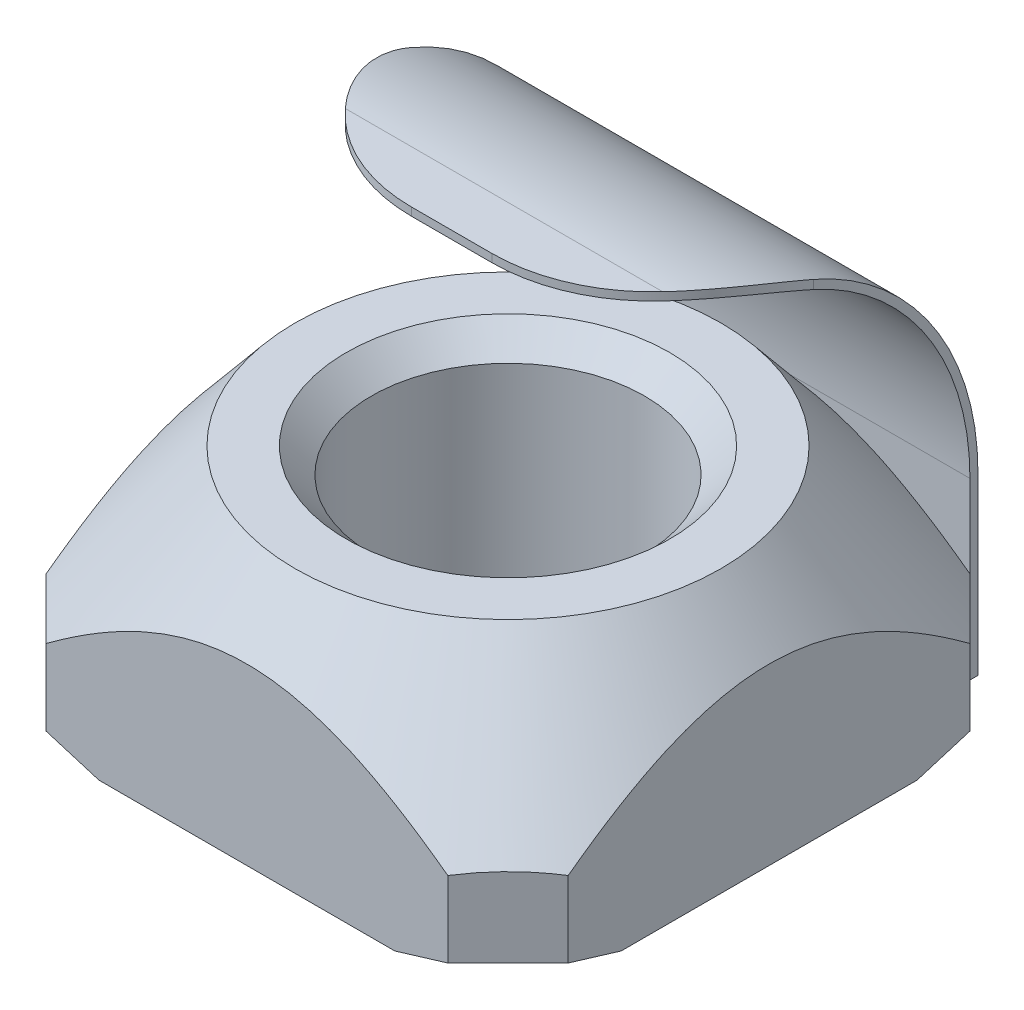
SolidWorks part; units mm, degrees
ref_plane "Front Plane" through (0, 0, 0) normal (0, 0, 1) x (1, 0, 0)
ref_plane "Top Plane" through (0, 0, 0) normal (0, 1, 0) x (1, 0, 0)
ref_plane "Right Plane" through (0, 0, 0) normal (1, 0, 0) x (0, 0, -1)
imported_body "Imported3"
sketch "Sketch1" plane through (0, 0, -6.5) normal (0, 0, -1) x (-1, 0, 0)
  line L0 (5, 11.1468) -> (5, 0)
  line L1 (5, 0) -> (-5, 0)
  line L2 (-5, 0) -> (-5, 11.1468)
  line L3 (-5, 11.1468) -> (5, 11.1468)
  line L4 (5.0002, 2.2872) -> (5.0002, 0.4294) construction
  dimension "D1" = 0.0002
  dimension "D2" = 10.0002
  dimension "D3" = 10.7175
  dimension "D4" = 0.4294
extrude "Boss-Extrude1" add sketch "Sketch1" along normal blind 0.2
sketch "Sketch2" plane through (0, 0, -6.5) normal (0, 0, 1) x (1, 0, 0)
  line L0 (-5, 11.1468) -> (5, 11.1468)
  line L1 (5, 11.1468) -> (5, 10.9468)
  line L2 (5, 10.9468) -> (-5, 10.9468)
  line L3 (-5, 10.9468) -> (-5, 11.1468)
  line L4 (-5.0001, 2.2872) -> (-5, 11.1468) construction
  dimension "D1" = 10
  dimension "D2" = 0.2
extrude "Boss-Extrude2" add sketch "Sketch2" along normal blind 7.9
hole_wizard "Ø6.8 (6.8) Diameter Hole1" positions "Sketch4" profile "Sketch3" hole size "Ø6.8" standard "ANSI Metric"
sketch "Sketch4" plane through (0, 5.8, 0) normal (0, 1, 0) x (1, 0, 0)
  point P0 (0, 0)
sketch "Sketch3" plane through (0, 5.8, 0) normal (1, 0, 0) x (0, 0, 1)
  line L0 (0, 0) -> (0, 5.8071)
  line L1 (0, 5.8071) -> (3.4, 5.8071)
  line L2 (3.4, 5.8071) -> (3.4, 0)
  line L5 (3.4, 0) -> (0, 0)
  line L11 (0, -6.35) -> (0, 107.95) construction
  dimension "Thru Hole Dia." = 6.8
  dimension "Thru Hole Depth" = 5.8071
fillet "Fillet1" radius 6.6 1 edges at (0, 10.9468, -6.5)
chamfer "Chamfer1" distance 1.4991 angle 45 2 edges at (-6.5, 0.5432, 6.5) (6.5, 0.5432, 6.5)
chamfer "Chamfer2" distance 0.4 angle 66.78 2 edges at (5.7505, 0, 5.7505)
chamfer "Chamfer3" distance 0.625 angle 45 1 edges at (0, 5.8, 3.4)
chamfer "Chamfer4" distance 0.9324 angle 23.22 1 edges at (-5.7505, 0, 5.7505)
fillet "Fillet2" radius 4 2 edges at (-5, 11.0468, 1.4) (5, 11.0468, 1.4)
fillet "Fillet3" radius 6.8 1 edges at (0, 11.1468, -6.7)
